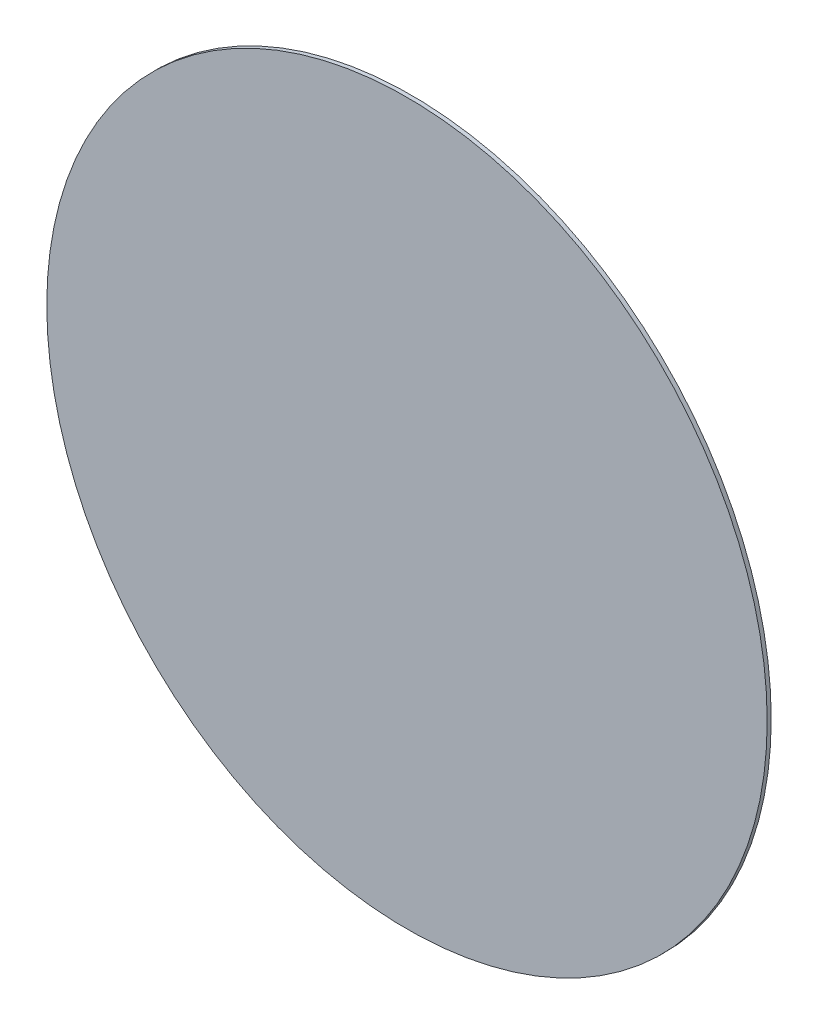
SolidWorks part; units mm, degrees
ref_plane "Front" through (0, 0, 0) normal (0, 0, 1) x (1, 0, 0)
ref_plane "Top" through (0, 0, 0) normal (0, 1, 0) x (1, 0, 0)
ref_plane "Right" through (0, 0, 0) normal (1, 0, 0) x (0, 0, -1)
sketch "Sketch1" plane through (0, 0, 0) normal (0, 0, 1) x (1, 0, 0)
  circle A0 centre (0, 0) radius 12.5
  dimension "D1" = 25
extrude "Extrude1" add sketch "Sketch1" along normal blind 0.14
